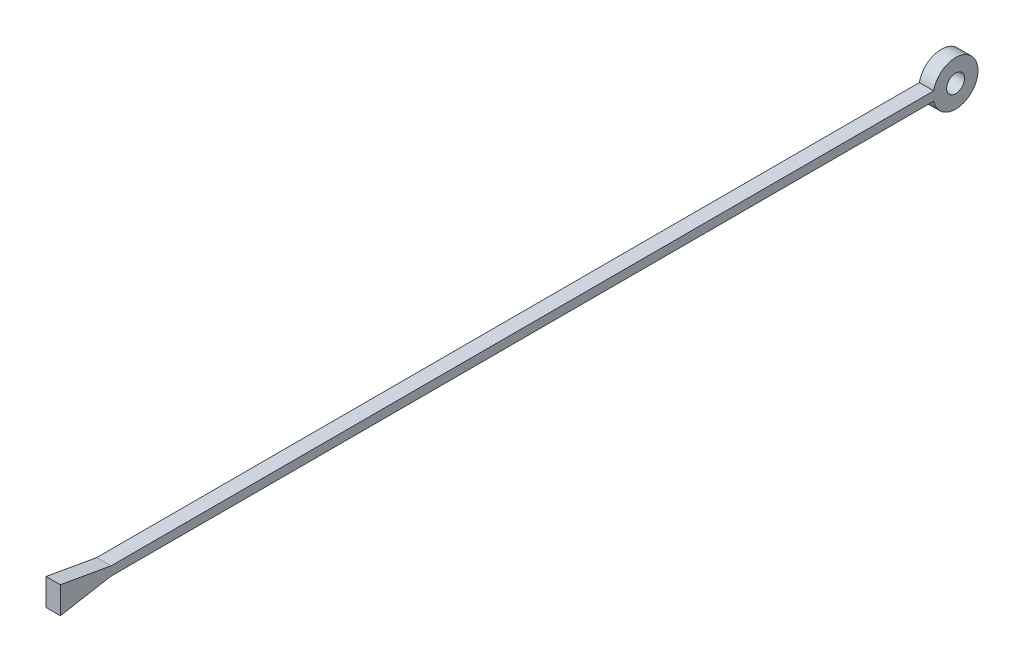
SolidWorks part; units mm, degrees
ref_plane "Front Plane" through (0, 0, 0) normal (0, 0, 1) x (1, 0, 0)
ref_plane "Top Plane" through (0, 0, 0) normal (0, 1, 0) x (1, 0, 0)
ref_plane "Right Plane" through (0, 0, 0) normal (1, 0, 0) x (0, 0, -1)
sketch "Sketch1" plane through (0, 0, 0) normal (1, 0, 0) x (0, 0, -1)
  line L0 (-500, 7.5) -> (-500, -7.5)
  line L1 (-471.6436, 2.5) -> (-12.2474, 2.5)
  line L2 (-471.6436, 2.5) -> (-500, 7.5)
  line L3 (-471.6436, -2.5) -> (-12.2474, -2.5)
  line L4 (-471.6436, -2.5) -> (-500, -7.5)
  arc A0 (-12.2474, -2.5) -> (-12.2474, 2.5) centre (0, 0) ccw
  circle A3 centre (0, 0) radius 5
  point P2 (-500, 0)
  dimension "D1" = 25
  dimension "D4" = 15
  dimension "D6" = 10
  dimension "D2" = 2.5
  dimension "D3" = 5
  dimension "D5" = 100
  dimension "D7" = 500
extrude "Boss-Extrude1" add sketch "Sketch1" along normal blind 8
